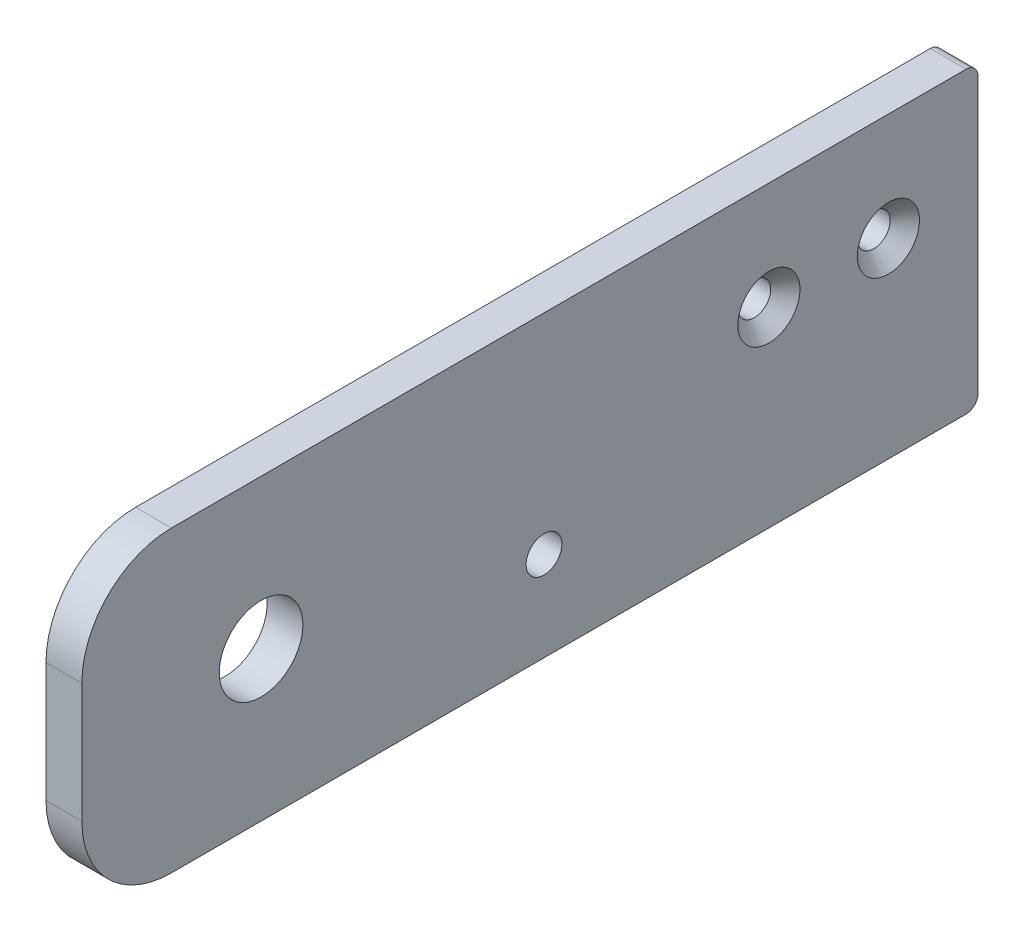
SolidWorks part; units mm, degrees
ref_plane "Alzado" through (0, 0, 0) normal (0, 0, 1) x (1, 0, 0)
ref_plane "Planta" through (0, 0, 0) normal (0, 1, 0) x (1, 0, 0)
ref_plane "Vista lateral" through (0, 0, 0) normal (1, 0, 0) x (0, 0, -1)
ref_plane "Plano1" through (6, 0, 0) normal (1, 0, 0) x (0, 0, -1)
sketch "Croquis1" plane through (6, 0, 0) normal (1, 0, 0) x (0, 0, -1)
  line L0 (0, 0) -> (-150, 0)
  line L1 (-150, 0) -> (-150, -50)
  line L2 (-150, -50) -> (0, -50)
  line L3 (0, -50) -> (0, 0)
  dimension "D1" = 150
  dimension "D2" = 50
  dimension "D3" = 0
  dimension "D4" = 0
extrude "Saliente-Extruir1" add sketch "Croquis1" against normal blind 6
sketch "Croquis2" plane through (0, 0, 0) normal (-1, 0, 0) x (0, 0, 1)
  line L0 (0, 0) -> (150, 0) construction
  line L1 (150, 0) -> (150, -50) construction
  circle A0 centre (72.6437, -35) radius 3
  point P6 (150, -25)
  dimension "D1" = 6
  dimension "D2" = 35
  dimension "D3" = 78
extrude "Cortar-Extruir1" cut sketch "Croquis2" against normal through all
hole_wizard "Avellanado para tornillo con cabeza plana de M51" positions "Croquis4" profile "Croquis3" countersink size "M5" standard "Ansi Metric"
sketch "Croquis4" plane through (6, 0, 0) normal (1, 0, 0) x (0, 0, -1)
  line L0 (0, -50) -> (0, 0) construction
  line L1 (0, 0) -> (-150, 0) construction
  point P0 (-15, -18)
  point P1 (-35, -18)
  dimension "D1" = 20
  dimension "D2" = 15
  dimension "D3" = 18
  dimension "D4" = 18
sketch "Croquis3" plane through (6, -18, 15) normal (0, 1, 0) x (0, 0, -1)
  line L0 (0, 0) -> (0, 6)
  line L1 (0, 6) -> (2.75, 6)
  line L2 (2.75, 6) -> (2.75, 2.45)
  line L3 (2.75, 2.45) -> (5.2, 0)
  line L5 (5.2, 0) -> (0, 0)
  line L6 (-2.75, 2.45) -> (-5.2, 0) construction
  line L11 (0, -6.35) -> (0, 107.95) construction
  dimension "Diámetro de taladro hasta el siguiente" = 5.5
  dimension "Profundidad de taladro hasta el siguiente" = 6
  dimension "Diámetro de avellanado cercano" = 10.4
  dimension "Ángulo de avellanado cercano" = 90
ref_plane "Plano2" through (0, 0, -42.1903) normal (0, 0, 1) x (1, 0, 0)
fillet "Redondeo1" radius 2 1 edges at (3, -50, 0)
fillet "Redondeo2" radius 15 1 edges at (3, -50, 150)
fillet "Redondeo3" radius 15 1 edges at (3, 0, 150)
fillet "Redondeo4" radius 2 1 edges at (3, 0, 0)
sketch "Croquis5" plane through (6, 0, 0) normal (1, 0, 0) x (0, 0, -1)
  line L0 (-2, 0) -> (-135, 0) construction
  line L1 (-150, -15) -> (-150, -35) construction
  circle A0 centre (-120, -25) radius 7
  dimension "D1" = 14
  dimension "D2" = 25
  dimension "D3" = 30
extrude "Cortar-Extruir2" cut sketch "Croquis5" against normal blind 10
